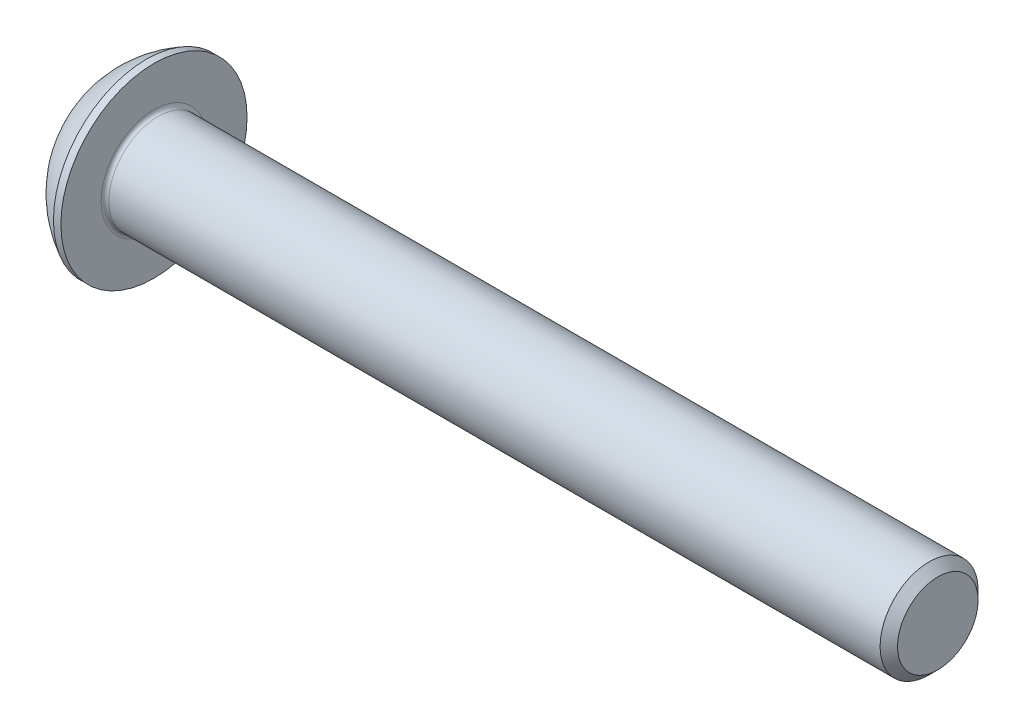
SolidWorks part; units mm, degrees
ref_plane "Plane1" through (0, 0, 0) normal (0, 0, 1) x (1, 0, 0)
ref_plane "Plane2" through (0, 0, 0) normal (0, 1, 0) x (1, 0, 0)
ref_plane "Plane3" through (0, 0, 0) normal (1, 0, 0) x (0, 0, -1)
revolve "BaseBody" add sketch "BodySke" angle 360 about L4
sketch "BodySke" plane through (0, 0, 0) normal (0, 0, 1) x (1, 0, 0)
  line L0 (42.75, 0) -> (42.75, 2.055)
  line L1 (42.305, 2.5) -> (2.75, 2.5)
  line L2 (2.75, 2.5) -> (2.75, 4.75)
  line L3 (2.75, 4.75) -> (2.37, 4.75)
  line L4 (0, 0) -> (101.6, 0) construction
  line L5 (2.75, -4.75) -> (2.37, -4.75) construction
  line L6 (55.6768, -2.5) -> (2.75, -2.5) construction
  line L7 (42.75, 0) -> (0, 0)
  line L8 (0, 2.375) -> (0, -2.375) construction
  line L9 (0, 0) -> (0, 2.375)
  line L10 (42.75, 2.055) -> (42.305, 2.5)
  line L11 (42.75, -2.055) -> (42.305, -2.5) construction
  line L12 (3.55, 9.525) -> (3.55, -2.5) construction
  line L13 (2.75, 9.525) -> (2.75, -2.5) construction
  arc A1 (0, 2.375) -> (2.37, 4.75) centre (4.755, 0) cw
  dimension "D1" = 4.75
  dimension "Diameter" = 5
  dimension "Length" = 40
  dimension "Head_dia" = 9.5
  dimension "Head_ht" = 2.75
  dimension "Head_side_ht" = 0.38
  dimension "Minor_dia" = 4.11
  dimension "Body_ch_ang" = 45
  dimension "Advance" = 0.8
  dimension "Thread_nom" = 40
fillet "Fillet1" radius 0.2 1 edges at (2.75, 0, 2.5)
sketch "Sketch2" plane through (0, 0, 0) normal (0, 0, 1) x (1, 0, 0)
  line L0 (0, 1.5) -> (1.56, 1.5)
  line L1 (1.56, 1.5) -> (2.426, 0)
  line L3 (2.426, 0) -> (0, 0)
  line L4 (0, 0) -> (0, 1.5)
  line L5 (0, -1.5) -> (1.56, -1.5) construction
  line L6 (0, 0) -> (47.625, 0) construction
  dimension "D2" = 60
  dimension "PreBroach_depth" = 1.56
  dimension "PreBroach_dia" = 3
revolve "PreBroach" cut sketch "Sketch2" angle 360 about L6
sketch "Sketch3" plane through (0, 0, 0) normal (1, 0, 0) x (0, 0, -1)
  line L0 (-1.5, -0.866) -> (-1.5, 0.866)
  line L1 (-1.5, 0.866) -> (0, 1.7321)
  line L2 (0, 1.7321) -> (1.5, 0.866)
  line L3 (1.5, 0.866) -> (1.5, -0.866)
  line L4 (1.5, -0.866) -> (0, -1.7321)
  line L5 (0, -1.7321) -> (-1.5, -0.866)
  dimension "D1" = 1.5
  dimension "D2" = 1.5
  dimension "D3" = 3
  dimension "Hex_size" = 3
extrude "Hex" cut sketch "Sketch3" along normal blind 1.56
sketch "ThdSchSke" plane through (0, 0, 0) normal (0, 0, 1) x (1, 0, 0)
  line L0 (4.35, -2.055) -> (4.0384, -2.5)
  line L1 (4.35, -2.055) -> (4.6616, -2.5)
  line L2 (4.6616, -2.5) -> (4.6616, -3.125)
  line L3 (-3.175, 0) -> (5.1513, 0) construction
  line L5 (4.6616, -3.125) -> (4.0384, -3.125)
  line L6 (4.0384, -3.125) -> (4.0384, -2.5)
  dimension "Thread_minor" = 4.11
  dimension "Diameter" = 5
  dimension "Start" = 4.35
  dimension "SideAngle" = 55
  dimension "VeeAngle" = 70
  dimension "Overcut" = 6.25
revolve "ThreadSchematic" [suppressed] cut sketch "ThdSchSke" angle 360 about L3
pattern_linear "ThdSchPat" [suppressed]
equation "\"D1@BodySke\" = \"Head_dia@BodySke\" * .5"
equation "\"Thread_minor@ThreadCosmetic\" = \"Minor_dia@BodySke\""
equation "\"D1@Sketch3\" = \"Hex_size@Sketch3\" / 2"
equation "\"D2@Sketch3\" = \"D1@Sketch3\""
equation "\"D3@Sketch3\" = \"Hex_size@Sketch3\""
equation "\"Thread_length@ThreadCosmetic\" = ((sgn( (\"Length@BodySke\" - \"Advance@BodySke\" * 2.0) - \"Thread_nom@BodySke\" )-1)*( (\"Length@BodySke\" - \"Advance@BodySke\" * 2.0) - \"Thread_nom@BodySke\" ))/-2+ \"Thread_no"
equation "\"Thread_minor@ThdSchSke\" = \"Minor_dia@BodySke\""
equation "\"Diameter@ThdSchSke\" = \"Diameter@BodySke\""
equation "\"Overcut@ThdSchSke\" = \"Diameter@BodySke\" * 1.25"
equation "\"Start@ThdSchSke\" = \"Head_ht@BodySke\" + \"Length@BodySke\" - \"Thread_length@ThreadCosmetic\"  '---Non-countersunk---"
equation "\"Num_threads@ThdSchPat\" = int( \"Thread_length@ThreadCosmetic\" / \"Advance@BodySke\" + 0.999 )  + 1"
equation "\"Advance@ThdSchPat\" = \"Thread_length@ThreadCosmetic\" /  (\"Num_threads@ThdSchPat\" - 1) 'relax it"
equation "\"Num_threads@ThdSchPat\" = \"Num_threads@ThdSchPat\" - sgn( \"Num_threads@ThdSchPat\" - 1) '---chamfered tips only---"
